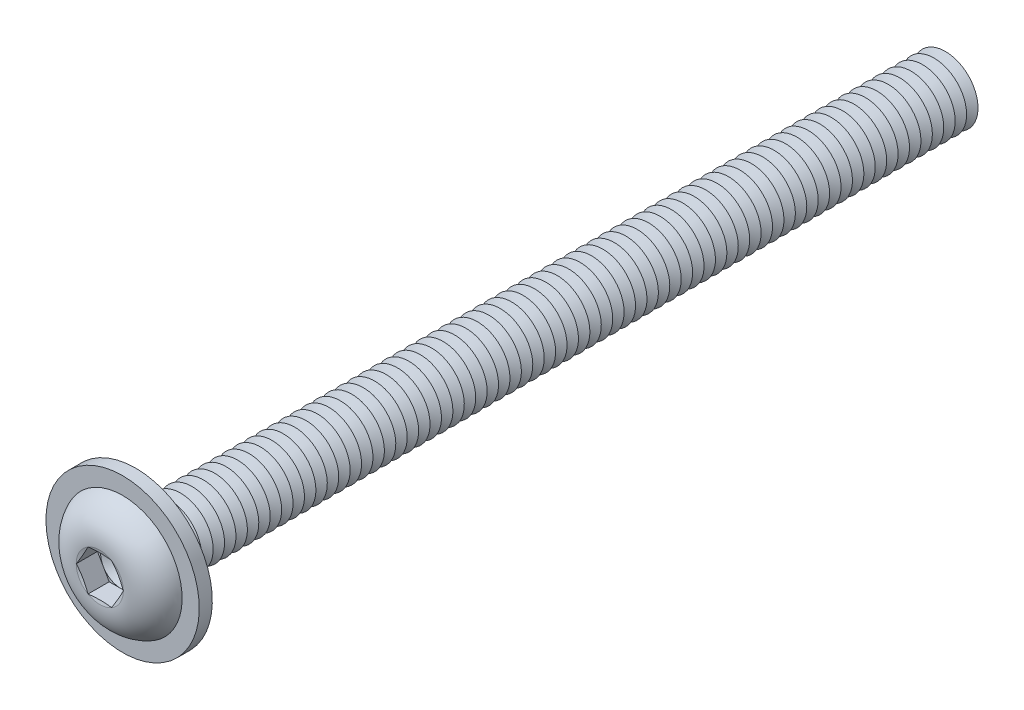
SolidWorks part; units mm, degrees
ref_plane "Front Plane" through (0, 0, 0) normal (0, 0, 1) x (1, 0, 0)
ref_plane "Top Plane" through (0, 0, 0) normal (0, 1, 0) x (1, 0, 0)
ref_plane "Right Plane" through (0, 0, 0) normal (1, 0, 0) x (0, 0, -1)
sketch "Sketch1" plane through (0, 0, 0) normal (1, 0, 0) x (0, 0, -1)
  line L0 (0, 2) -> (0, 3.8)
  line L3 (0, 2) -> (50, 2)
  line L4 (50, 2) -> (50, 0)
  line L5 (50, 0) -> (-2.2, 0) construction
  line L6 (-2.2, 0) -> (50, 0)
  line L7 (-2.2, 1.4434) -> (-2.2, 0.7217) construction
  line L8 (-2.2, 0.7217) -> (-2.2, 0)
  line L9 (-2.2, 1.4434) -> (-2.0066, 0.7217)
  line L10 (-2.0066, 0.7217) -> (-2.2, 0.7217)
  line L11 (50, 0) -> (22.7481, 0) construction
  line L12 (0, 3.8) -> (-2.2, 3.8) construction
  arc A1 (0, 3.8) -> (-2.2, 1.4434) centre (0, 1.5948) ccw
  point P8 (50, 1)
  dimension "D1" = 7.6
  dimension "D2" = 4
  dimension "D3" = 2.2
  dimension "D4" = 2.8868
  dimension "D5" = 50
  dimension "D6" = 15
revolve "Revolve1" add sketch "Sketch1" angle 360 about L5
fillet "Fillet1" radius 0.35 1 edges at (0, 2, 0)
sketch "Sketch2" plane through (0, 0, 0) normal (1, 0, 0) x (0, 0, -1)
  line L0 (49.65, 2) -> (50.35, 2)
  line L1 (50, 2) -> (0.35, 2) construction
  line L2 (50.35, 2) -> (50, 1.3938)
  line L3 (50, -2) -> (50, 2) construction
  line L4 (50, 1.3938) -> (49.65, 2)
  dimension "D1" = 0.7
revolve "Cut-Revolve1" cut sketch "Sketch2" angle 360 about axis through (0, 0, -50) along (0, 0, -1)
pattern_linear "LPattern1" count 71 spacing 0.7 along (0, 0, 1) of "Cut-Revolve1"
sketch "Sketch3" plane through (0, 0, 2.2) normal (0, 0, 1) x (1, 0, 0)
  line L7 (0.7217, 1.25) -> (-0.7217, 1.25)
  line L8 (-0.7217, 1.25) -> (-1.4434, 0)
  line L9 (-1.4434, 0) -> (-0.7217, -1.25)
  line L10 (-0.7217, -1.25) -> (0.7217, -1.25)
  line L11 (0.7217, -1.25) -> (1.4434, 0)
  line L12 (1.4434, 0) -> (0.7217, 1.25)
  circle A0 centre (0, 0) radius 1.25 construction
  circle A3 centre (0, 0) radius 1.4434 construction
extrude "Cut-Extrude1" cut sketch "Sketch3" against normal blind 1.3
sketch "Sketch4" plane through (0, 0, 0.9) normal (0, 0, 1) x (1, 0, 0)
  line L1 (0.7217, 1.25) -> (-0.7217, 1.25) construction
  circle A0 centre (0, 0) radius 1.25
extrude "Cut-Extrude2" cut sketch "Sketch4" against normal through all draft 60
sketch "Sketch5" plane through (0, 0, 0) normal (0, 0, -1) x (-1, 0, 0)
  circle A0 centre (0, 0) radius 4.7
  circle A1 centre (0, 0) radius 2.35
  circle A2 centre (0, 0) radius 2.35 construction
  dimension "D1" = 9.4
extrude "Boss-Extrude1" add sketch "Sketch5" against normal blind 0.8
